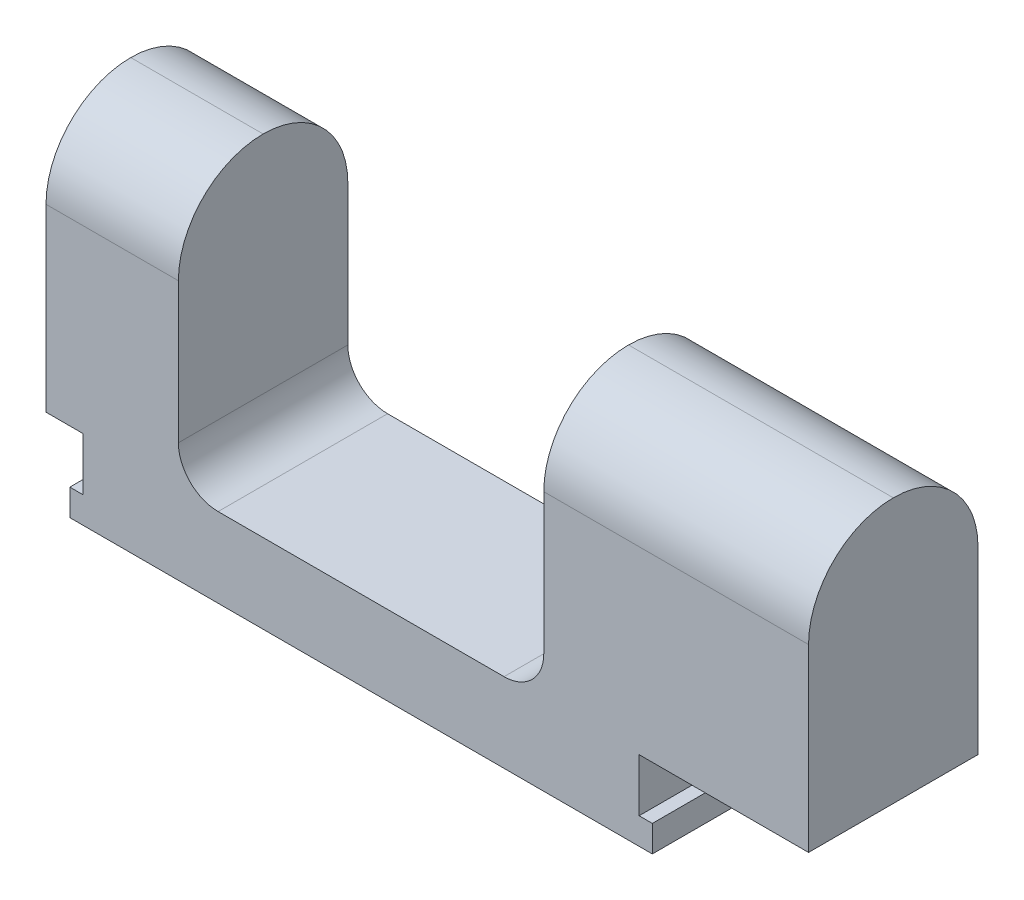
SolidWorks part; units mm, degrees
ref_plane "Face" through (0, 0, 0) normal (0, 0, 1) x (1, 0, 0)
ref_plane "Dessus" through (0, 0, 0) normal (0, 1, 0) x (1, 0, 0)
ref_plane "Droite" through (0, 0, 0) normal (1, 0, 0) x (0, 0, -1)
sketch "Esquisse1" plane through (0, 0, 0) normal (0, 0, 1) x (1, 0, 0)
  line L0 (-550, 0) -> (550, 0)
  line L1 (-525, 50) -> (-525, 150)
  line L2 (845, 650) -> (345, 650)
  line L3 (345, 650) -> (345, 225)
  line L4 (270, 150) -> (-270, 150)
  line L5 (-345, 225) -> (-345, 650)
  line L6 (-345, 650) -> (-595, 650)
  line L7 (-550, 50) -> (-525, 50)
  line L8 (-550, 50) -> (-550, 0)
  line L9 (-525, 150) -> (-595, 150)
  line L10 (550, 50) -> (525, 50)
  line L11 (550, 50) -> (550, 0)
  line L12 (525, 50) -> (525, 150)
  line L13 (525, 150) -> (845, 150)
  line L14 (-595, 150) -> (-595, 650)
  line L15 (845, 650) -> (845, 150)
  arc A0 (-270, 150) -> (-345, 225) centre (-270, 225) cw
  arc A1 (345, 225) -> (270, 150) centre (270, 225) cw
  point P15 (-345, 150)
  point P18 (345, 150)
  dimension "D9" = 75
  dimension "D1" = 690
  dimension "D2" = 345
  dimension "D3" = 1100
  dimension "D4" = 150
  dimension "D5" = 100
  dimension "D6" = 25
  dimension "D7" = 500
  dimension "D8" = 50
  dimension "D10" = 25
  dimension "D11" = 500
  dimension "D12" = 250
extrude "Extrusion1" add sketch "Esquisse1" along normal mid plane 320
fillet "Congé1" radius 160 8 edges at (-470, 650, -160) (595, 650, -160) (595, 650, 160) (-595, 650, 0) (-345, 650, 0) (345, 650, 0) (845, 650, 0) (-470, 650, 160)
